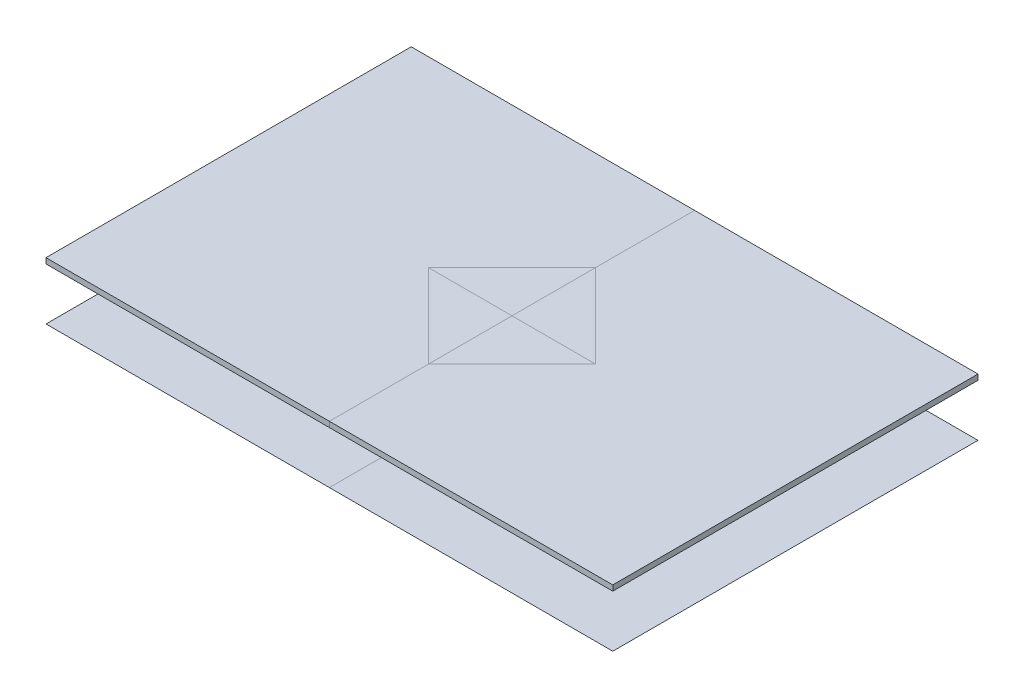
SolidWorks part; units mm, degrees
ref_plane "Front Plane" through (0, 0, 0) normal (0, 0, 1) x (1, 0, 0)
ref_plane "Top Plane" through (0, 0, 0) normal (0, 1, 0) x (1, 0, 0)
ref_plane "Right Plane" through (0, 0, 0) normal (1, 0, 0) x (0, 0, -1)
sketch "Sketch2" plane through (0, 0, 0) normal (0, 1, 0) x (1, 0, 0)
  line L0 (0, 33.3821) -> (0, -33.3821) construction
  line L1 (-51.8038, 33.3821) -> (51.8038, 33.3821)
  line L2 (-51.8038, 33.3821) -> (-51.8038, -33.3821)
  line L3 (-51.8038, -33.3821) -> (51.8038, -33.3821)
  line L4 (51.8038, 33.3821) -> (51.8038, -33.3821)
  line L5 (0, 15.2356) -> (15.2356, 0) construction
  line L6 (0, -15.2356) -> (15.2356, 0) construction
  line L7 (0, 15.2356) -> (-15.2356, 0) construction
  line L8 (0, -15.2356) -> (-15.2356, 0) construction
  line L9 (-15.2356, 0) -> (15.2356, 0) construction
surface "Surface-Plane1" sketch "Sketch2"
sketch "Sketch4" plane through (0, 0, 0) normal (0, 1, 0) x (1, 0, 0)
  line L0 (0, 33.3821) -> (0, -33.3821) construction
  line L1 (0, 33.3821) -> (0, -33.3821)
sketch "Sketch5" plane through (0, 0, 0) normal (0, 1, 0) x (1, 0, 0)
  line L0 (0, 15.2356) -> (15.2356, 0) construction
  line L1 (0, 15.2356) -> (-15.2356, 0) construction
  line L2 (0, -15.2356) -> (-15.2356, 0) construction
  line L3 (0, -15.2356) -> (15.2356, 0) construction
  line L4 (0, 15.2356) -> (15.2356, 0)
  line L5 (0, 15.2356) -> (-15.2356, 0)
  line L6 (0, -15.2356) -> (-15.2356, 0)
  line L7 (0, -15.2356) -> (15.2356, 0)
sketch "Sketch6" plane through (0, 0, 0) normal (0, 1, 0) x (1, 0, 0)
  line L0 (-15.2356, 0) -> (15.2356, 0) construction
  line L1 (-15.2356, 0) -> (15.2356, 0)
surface "Surface-Offset1" parameters "D1"=10
surface "Surface-Offset2" parameters "D1"=10
surface "Surface-Offset3" parameters "D1"=10
surface "Surface-Offset4" parameters "D1"=10
surface "Surface-Offset5" parameters "D1"=10
surface "Surface-Offset6" parameters "D1"=10
thicken "Thicken2" thickness 0.5 thickness side both sides parameters "D1"=0.5
thicken "Thicken3" thickness 0.5 thickness side both sides parameters "D1"=0.5
thicken "Thicken4" thickness 0.5 thickness side both sides parameters "D1"=0.5
thicken "Thicken5" thickness 0.5 thickness side both sides parameters "D1"=0.5
thicken "Thicken6" thickness 0.5 thickness side both sides parameters "D1"=0.5
thicken "Thicken7" thickness 0.5 thickness side both sides parameters "D1"=0.5
other "Save Bodies1"
